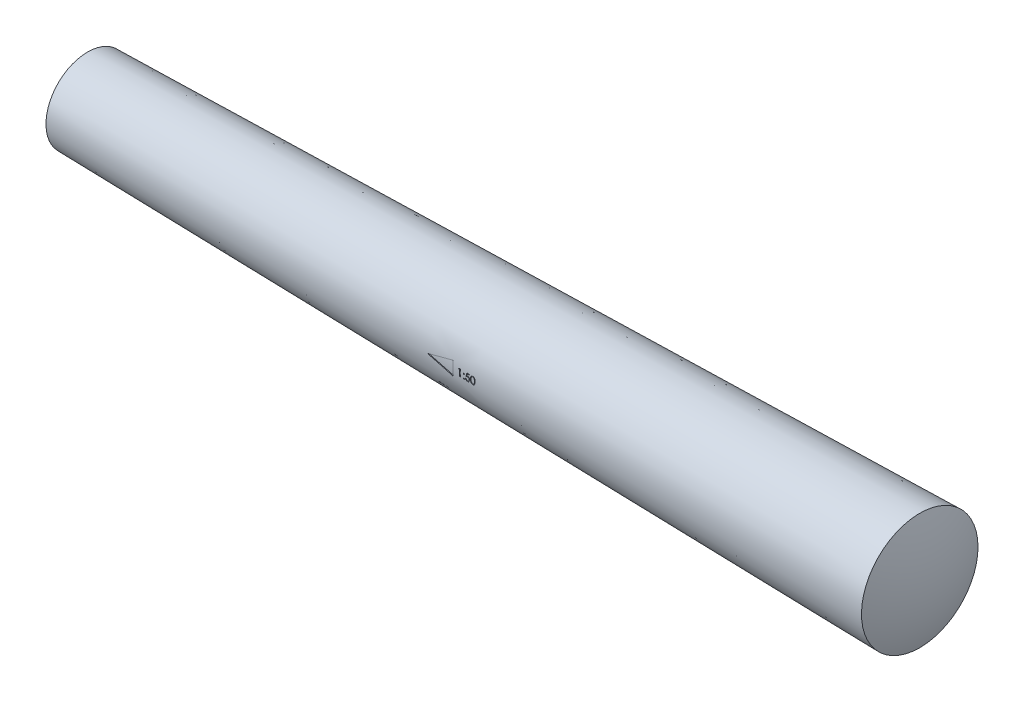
SolidWorks part; units mm, degrees
ref_plane "Front Plane" through (0, 0, 0) normal (0, 0, 1) x (1, 0, 0)
ref_plane "Top Plane" through (0, 0, 0) normal (0, 1, 0) x (1, 0, 0)
ref_plane "Right Plane" through (0, 0, 0) normal (1, 0, 0) x (0, 0, -1)
sketch "Sketch1" plane through (0, 0, 0) normal (1, 0, 0) x (0, 0, -1)
  circle A0 centre (0, 0) radius 6
  dimension "D1" = 12
extrude "Extrude1" add sketch "Sketch1" along normal mid plane 120
draft "Draft1" type of draft neutral plane draft angle 1.146 faces to draft 1 parameters "D1"=1.146
sketch "Sketch2" plane through (0, 0, 0) normal (0, 0, 1) x (1, 0, 0)
  line L0 (-60, 0) -> (-60, 6)
  line L1 (-60, 6) -> (-60, -6) construction
  line L2 (-60, 0) -> (-61.6, 0)
  line L3 (-61.6, 0) -> (-61.6, -7.2) construction
  line L4 (60, 0) -> (60, 8.4001)
  line L5 (60, -8.4001) -> (60, 8.4001) construction
  line L6 (60, 0) -> (61.6, 0)
  line L7 (61.6, 0) -> (61.6, -7.2) construction
  line L8 (-60, -6) -> (60, -8.4001) construction
  arc A0 (-61.6, 0) -> (-60, 6) centre (-49.55, 0) cw
  arc A1 (61.6, 0) -> (60, 8.4001) centre (38.7496, 0) ccw
  point P14 (0, -7.2)
revolve "Revolve1" add sketch "Sketch2" angle 360 about L2
sketch "Sketch5" plane through (0, 0, 0) normal (0, 0, 1) x (1, 0, 0)
  line L0 (0, 7.2) -> (0, -7.2) construction
  line L1 (60, 8.4001) -> (-60, 6) construction
  line L2 (-60, -6) -> (60, -8.4001) construction
ref_plane "Plane2" through (0, 0, 0) normal (-0.02, 0, 0.9998) x (0.9998, 0, 0.02)
sketch "Sketch6" plane through (0, 0, 0) normal (-0.02, 0, 0.9998) x (0.9998, 0, 0.02)
  line L0 (0, 0) -> (0, 1)
  line L1 (0, 7.2) -> (0, -7.2) construction
  line L2 (0, 1) -> (-3.7321, 0)
  line L3 (-3.7321, 0) -> (0, -1)
  line L4 (0, -1) -> (0, 0)
  line L5 (0, -0.5) -> (4, -0.5) construction
  text T0 "1:50" font "Century Gothic" height 1
  dimension "D1" = 2
  dimension "D2" = 30
  dimension "D3" = 4
wrap "Wrap2" sketch "Sketch6" wrap type deboss source sketch "Sketch6" thickness 0.1 parameters "D1"=0.1
equation "\"D2@Sketch2\" = \"D1@Sketch2\""
